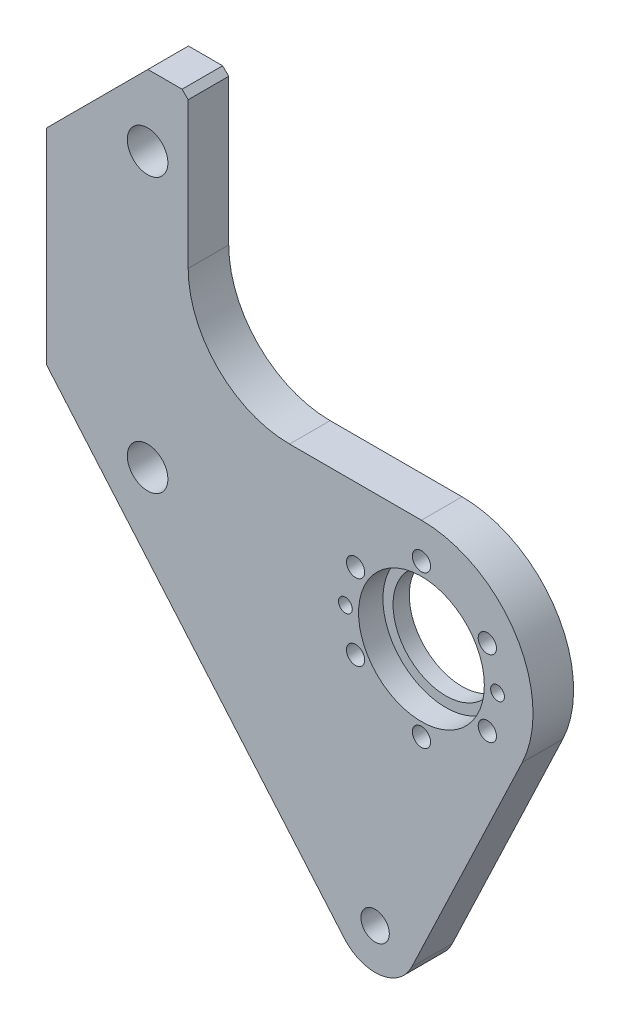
SolidWorks part; units mm, degrees
ref_plane "Face" through (0, 0, 0) normal (0, 0, 1) x (1, 0, 0)
ref_plane "Dessus" through (0, 0, 0) normal (0, 1, 0) x (1, 0, 0)
ref_plane "Droite" through (0, 0, 0) normal (1, 0, 0) x (0, 0, -1)
sketch "Esquisse1" plane through (0, 0, 0) normal (0, 0, 1) x (1, 0, 0)
  line L0 (0, 92.3792) -> (0, -113.1174) construction
  line L1 (103.1254, 0) -> (-116.3224, 0) construction
  line L2 (49.6692, -23.6214) -> (-4.7785, -138.1096)
  line L3 (-184.8697, 130) -> (-134.8697, 180)
  line L4 (-184.8697, 29) -> (-184.8697, 130)
  line L5 (-38.0333, -142.5263) -> (-184.8697, 29)
  line L6 (-65, 55) -> (0, 55)
  line L7 (-134.8697, 180) -> (-115, 180)
  line L8 (-115, 105) -> (-115, 180)
  circle A0 centre (0, 0) radius 26
  arc A1 (49.6692, -23.6214) -> (0, 55) centre (0, 0) ccw
  arc A2 (-38.0333, -142.5263) -> (-4.7785, -138.1096) centre (-22.84, -129.52) ccw
  arc A3 (-65, 55) -> (-115, 105) centre (-65, 105) cw
  circle A4 centre (-135, 10) radius 10
  circle A5 centre (-135, 145) radius 10
  point P8 (-22.84, -129.52)
  point P10 (-135, 145)
  point P16 (-135, 10)
  dimension "D1" = 52
  dimension "D2" = 110
  dimension "D5" = 40
  dimension "D11" = 50
  dimension "D17" = 20
  dimension "D18" = 20
  dimension "D3" = 129.52
  dimension "D4" = 22.84
  dimension "D6" = 66
  dimension "D7" = 50
  dimension "D8" = 50
  dimension "D9" = 180
  dimension "D10" = 115
  dimension "D12" = 29
  dimension "D13" = 10
  dimension "D14" = 135
  dimension "D15" = 135
  dimension "D16" = 135
extrude "Base-Extrusion" add sketch "Esquisse1" against normal blind 20
chamfer "Chanfrein1" distance 3 angle 45
hole_wizard "Trou taraudé M16x2.01" positions "Esquisse3D1" profile "Esquisse2" tap size "M16x2.0" standard "ISO"
sketch3d "Esquisse3D1"
  point P0 (-22.84, -129.52, 0)
sketch "Esquisse2" plane through (-22.84, -129.52, 0) normal (1, 0, 0) x (0, -1, 0)
  line L0 (0, 0) -> (0, 20)
  line L1 (0, 20) -> (7, 20)
  line L2 (7, 20) -> (7, 0)
  line L5 (7, 0) -> (0, 0)
  line L11 (0, -6.35) -> (0, 107.95) construction
  dimension "Diamètre du perçage jusqu'au prochain" = 14
  dimension "Profondeur du perçage jusqu'au prochain" = 20
sketch "Esquisse3" plane through (0, 0, 0) normal (0, 0, 1) x (1, 0, 0)
  line L0 (-129.5569, -74.7997) -> (129.5569, 74.7997) construction
  line L1 (-91.6421, 52.9096) -> (91.6421, -52.9096) construction
  line L2 (0, 92.3792) -> (0, -113.1174) construction
  circle A0 centre (0, 0) radius 37.5 construction
  circle A1 centre (32.476, 18.75) radius 4.5
  circle A2 centre (32.476, -18.75) radius 4.5
  circle A3 centre (0, -37.5) radius 4.5
  circle A4 centre (-32.476, -18.75) radius 4.5
  circle A5 centre (-32.476, 18.75) radius 4.5
  circle A6 centre (0, 37.5) radius 4.5
  dimension "D1" = 75
  dimension "D4" = 9
  dimension "D5" = 9
  dimension "D6" = 9
  dimension "D7" = 9
  dimension "D8" = 9
  dimension "D9" = 9
  dimension "D2" = 60
  dimension "D3" = 60
extrude "Enlèv. mat.-Extru.1" cut sketch "Esquisse3" against normal blind 20
hole_wizard "Trou taraudé M8x1.251" positions "Esquisse3D2" profile "Esquisse4" tap size "M8x1.25" standard "ISO"
sketch3d "Esquisse3D2"
  line L0 (103.1254, 0, 0) -> (-116.3224, 0, 0) construction
  circle A0 centre (0, 0, 0) radius 37.5 construction
  point P0 (-37.5, 0, 0)
  point P1 (37.5, 0, 0)
  point P6 (0, 0, 37.5)
sketch "Esquisse4" plane through (-37.5, 0, 0) normal (1, 0, 0) x (0, -1, 0)
  line L0 (0, 0) -> (0, 24.2929)
  line L1 (0, 24.2929) -> (3.4, 22.25)
  line L2 (3.4, 22.25) -> (3.4, 0)
  line L5 (3.4, 0) -> (0, 0)
  line L10 (0, 24.2929) -> (-3.4, 22.25) construction
  line L11 (0, -6.35) -> (0, 107.95) construction
  dimension "Diamètre du perçage" = 6.8
  dimension "Profondeur du perçage" = 22.25
  dimension "Angle de pointe" = 118
sketch "Esquisse5" plane through (0, 0, 0) normal (0, 0, 1) x (1, 0, 0)
  circle A0 centre (0, 0) radius 31
  dimension "D1" = 62
extrude "Enlèv. mat.-Extru.3" cut sketch "Esquisse5" against normal blind 12
